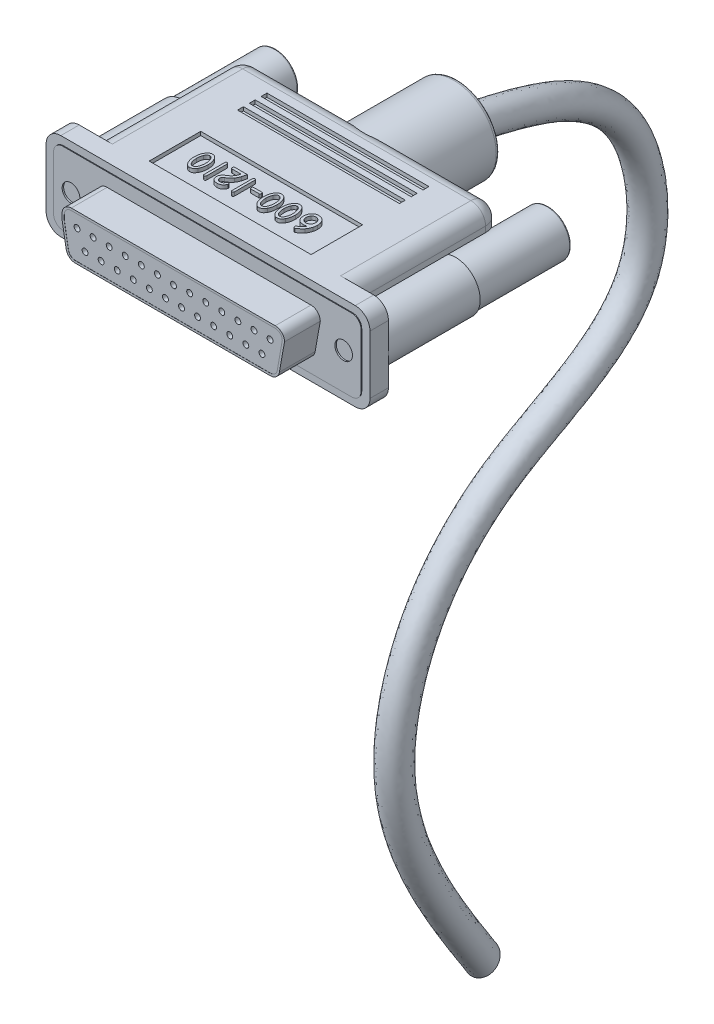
SolidWorks part; units mm, degrees
ref_plane "Plane1" through (0, 0, 0) normal (0, 0, 1) x (1, 0, 0)
ref_plane "Plane2" through (0, 0, 0) normal (0, 1, 0) x (1, 0, 0)
ref_plane "Plane3" through (0, 0, 0) normal (1, 0, 0) x (0, 0, -1)
extrude "Base-Extrude" add sketch "Sketch1" against normal blind 1.0668
sketch "Sketch1" plane through (0, 0, 0) normal (0, 0, 1) x (1, 0, 0)
  line L0 (0, 19.6596) -> (0, -19.1008) construction
  line L1 (-24.9174, 6.2738) -> (24.9174, 6.2738)
  line L2 (24.9174, -6.2738) -> (-24.9174, -6.2738)
  line L3 (26.5176, 4.6736) -> (26.5176, -4.6736)
  line L4 (-26.5176, 4.6736) -> (-26.5176, -4.6736)
  arc A0 (26.5176, 4.6736) -> (24.9174, 6.2738) centre (24.9174, 4.6736) ccw
  arc A1 (24.9174, -6.2738) -> (26.5176, -4.6736) centre (24.9174, -4.6736) ccw
  arc A2 (-26.5176, -4.6736) -> (-24.9174, -6.2738) centre (-24.9174, -4.6736) ccw
  arc A3 (-24.9174, 6.2738) -> (-26.5176, 4.6736) centre (-24.9174, 4.6736) ccw
  point P9 (26.5176, 6.2738)
  point P12 (26.5176, -6.2738)
  point P15 (-26.5176, -6.2738)
  point P18 (-26.5176, 6.2738)
  dimension "D1" = 1.6002
sketch "Sketch2" plane through (0, 0, -1.0668) normal (0, 0, -1) x (-1, 0, 0)
  line L0 (-26.5176, 6.2738) -> (26.5176, 6.2738)
  line L1 (-26.5176, 6.2738) -> (-26.5176, -6.2738)
  line L2 (26.5176, -6.2738) -> (-26.5176, -6.2738)
  line L3 (26.5176, -6.2738) -> (26.5176, 6.2738)
extrude "Boss-Extrude1" add sketch "Sketch2" along normal blind 6.477
sketch "Sketch10" plane through (0, 0, 0) normal (0, 0, 1) x (1, 0, 0)
  line L0 (0, 10.3378) -> (0, -10.8966) construction
  line L1 (-24.9174, 6.2738) -> (24.9174, 6.2738) construction
  circle A0 centre (23.5204, 0) radius 1.524
  circle A1 centre (-23.5204, 0) radius 1.524
  dimension "D1" = 3.048
  dimension "D2" = 6.2738
  dimension "D3" = 47.0408
extrude "Cut-Extrude5" cut sketch "Sketch10" against normal through all
ref_plane "Plane5" through (5.715, 0, 0) normal (1, 0, 0) x (0, 0, -1)
sketch "Sketch17" plane through (0, 6.2738, 0) normal (0, 1, 0) x (-1, 0, 0)
  line L8 (-24.9174, 0) -> (-24.9174, -1.0668)
  line L9 (-24.9174, -1.0668) -> (-26.5176, -1.0668)
  line L10 (-26.5176, -1.0668) -> (-26.5176, -7.5438)
  line L11 (-26.5176, -7.5438) -> (26.5176, -7.5438)
  line L12 (26.5176, -7.5438) -> (26.5176, -1.0668)
  line L13 (26.5176, -1.0668) -> (24.9174, -1.0668)
  line L14 (24.9174, -1.0668) -> (24.9174, 0)
  line L15 (24.9174, 0) -> (-24.9174, 0)
  line L17 (-24.9174, -1.0668) -> (-26.5176, -1.0668)
  line L18 (-26.5176, -1.0668) -> (-26.5176, -7.5438)
  line L19 (-26.5176, -7.5438) -> (26.5176, -7.5438)
  line L20 (26.5176, -7.5438) -> (26.5176, -1.0668)
  line L21 (26.5176, -1.0668) -> (-24.9174, -1.0668)
  dimension "D1" = 0
extrude "Cut-Extrude7" cut sketch "Sketch17" against normal through all
ref_plane "Plane6" through (0, 0, -0.127) normal (0, 0, 1) x (1, 0, 0)
sketch "Sketch18" plane through (0, 0, -0.127) normal (0, 0, 1) x (1, 0, 0)
  line L0 (-25.4, 7.5692) -> (25.4, 7.5692)
  line L1 (-27.94, 5.0292) -> (-27.94, -5.0292)
  line L2 (25.4, -7.5692) -> (-25.4, -7.5692)
  line L3 (27.94, -5.0292) -> (27.94, 5.0292)
  arc A0 (27.94, 5.0292) -> (25.4, 7.5692) centre (25.4, 5.0292) ccw
  arc A1 (25.4, -7.5692) -> (27.94, -5.0292) centre (25.4, -5.0292) ccw
  arc A2 (-27.94, -5.0292) -> (-25.4, -7.5692) centre (-25.4, -5.0292) ccw
  arc A3 (-25.4, 7.5692) -> (-27.94, 5.0292) centre (-25.4, 5.0292) ccw
  point P12 (23.5204, 0)
  point P13 (-23.5204, 0)
  dimension "D1" = 2.54
  dimension "D2" = 55.88
  dimension "D3" = 15.1384
  dimension "D4" = 7.5692
  dimension "D5" = 27.94
extrude "Boss-Extrude8" add sketch "Sketch18" against normal blind 3.175
sketch "Sketch19" plane through (0, 0, -3.302) normal (0, 0, -1) x (-1, 0, 0)
  line L0 (-19.685, 7.5692) -> (19.685, 7.5692)
  line L1 (-22.225, 5.0292) -> (-22.225, 4.0525)
  line L2 (19.685, -7.5692) -> (-19.685, -7.5692)
  line L3 (22.225, -5.0292) -> (22.225, -4.0525)
  line L4 (25.4, 7.5692) -> (-25.4, 7.5692) construction
  line L5 (-25.4, -7.5692) -> (25.4, -7.5692) construction
  line L6 (22.225, 4.0525) -> (22.225, 5.0292)
  line L7 (-22.225, -4.0525) -> (-22.225, -5.0292)
  arc A0 (22.225, 4.0525) -> (22.225, -4.0525) centre (23.5204, 0) ccw
  arc A1 (-22.225, -4.0525) -> (-22.225, 4.0525) centre (-23.5204, 0) ccw
  arc A2 (19.685, 7.5692) -> (22.225, 5.0292) centre (19.685, 5.0292) cw
  arc A3 (19.685, -7.5692) -> (22.225, -5.0292) centre (19.685, -5.0292) ccw
  arc A4 (-22.225, -5.0292) -> (-19.685, -7.5692) centre (-19.685, -5.0292) ccw
  arc A5 (-19.685, 7.5692) -> (-22.225, 5.0292) centre (-19.685, 5.0292) ccw
  point P20 (22.225, 7.5692)
  point P23 (22.225, -7.5692)
  point P28 (-22.225, 7.5692)
  dimension "D3" = 8.509
  dimension "D4" = 8.509
  dimension "D5" = 2.54
  dimension "D1" = 44.45
  dimension "D2" = 22.225
extrude "Boss-Extrude10" add sketch "Sketch19" along normal blind 25.019
fillet "Fillet10" radius 2.54 7 edges at (0, -7.5692, -28.321) (22.225, -4.5408, -28.321) (21.4811, -6.8253, -28.321) (-21.4811, -6.8253, -28.321) (-22.225, -4.5408, -28.321)
fillet "Fillet11" radius 2.54 7 edges at (-21.4811, 6.8253, -28.321) (0, 7.5692, -28.321) (-22.225, 4.5408, -28.321) (21.4811, 6.8253, -28.321) (22.225, 4.5408, -28.321)
sketch "Sketch20" plane through (0, 0, -0.127) normal (0, 0, 1) x (1, 0, 0)
  circle A1 centre (-23.5204, 0) radius 1.524
  circle A2 centre (-23.5204, 0) radius 1.524
  circle A3 centre (23.5204, 0) radius 1.524
  circle A4 centre (23.5204, 0) radius 1.524
  dimension "D1" = 0
  dimension "D2" = 0
sketch "Sketch21" plane through (0, 0, -3.302) normal (0, 0, -1) x (-1, 0, 0)
  circle A0 centre (23.5204, 0) radius 4.2545
  circle A1 centre (-23.5204, 0) radius 4.2545
  arc A2 (22.225, 4.0525) -> (22.225, -4.0525) centre (23.5204, 0) ccw construction
extrude "Boss-Extrude13" add sketch "Sketch21" along normal blind 16.002
sketch "Sketch23" plane through (0, 0, -19.304) normal (0, 0, -1) x (-1, 0, 0)
  circle A0 centre (23.5204, 0) radius 1.5875
  circle A1 centre (-23.5204, 0) radius 1.5875
  dimension "D1" = 3.175
  dimension "D2" = 3.175
extrude "Boss-Extrude14" add sketch "Sketch23" along normal blind 0.127
sketch "Sketch24" plane through (0, 0, -19.431) normal (0, 0, -1) x (-1, 0, 0)
  circle A0 centre (23.5204, 0) radius 3.937
  circle A1 centre (-23.5204, 0) radius 3.937
  dimension "D1" = 7.874
  dimension "D2" = 7.874
extrude "Boss-Extrude15" add sketch "Sketch24" along normal blind 15.875
extrude "Cut-Extrude9" cut sketch "Sketch20" against normal blind 0.127
fillet "Fillet12" radius 0.254 2 edges at (-27.4574, 0, -35.306) (19.5834, 0, -35.306)
sketch "Sketch25" plane through (0, 0, -35.306) normal (0, 0, -1) x (-1, 0, 0)
  line L0 (23.2987, 2.4625) -> (25.5122, -1.4647)
  line L1 (21.5286, 1.4647) -> (23.7421, -2.4625)
  line L2 (-23.7421, 2.4625) -> (-21.5286, -1.4647)
  line L3 (-25.5122, 1.4647) -> (-23.2987, -2.4625)
  arc A0 (24.5105, -2.7481) -> (25.3587, -2.27) centre (23.5204, 0) ccw
  arc A1 (23.2987, 2.4625) -> (22.5303, 2.7481) centre (22.7456, 2.1507) ccw
  arc A2 (21.5286, 1.4647) -> (21.6821, 2.27) centre (22.0817, 1.7765) cw
  arc A3 (24.5105, -2.7481) -> (23.7421, -2.4625) centre (24.2952, -2.1507) cw
  arc A4 (25.5122, -1.4647) -> (25.3587, -2.27) centre (24.9591, -1.7765) cw
  circle A5 centre (23.5204, 0) radius 2.921
  arc A6 (22.5303, 2.7481) -> (21.6821, 2.27) centre (23.5204, 0) ccw
  arc A9 (-22.5303, -2.7481) -> (-21.6821, -2.27) centre (-23.5204, 0) ccw
  arc A10 (-23.7421, 2.4625) -> (-24.5105, 2.7481) centre (-24.2952, 2.1507) ccw
  arc A11 (-25.5122, 1.4647) -> (-25.3587, 2.27) centre (-24.9591, 1.7765) cw
  arc A12 (-22.5303, -2.7481) -> (-23.2987, -2.4625) centre (-22.7456, -2.1507) cw
  arc A13 (-21.5286, -1.4647) -> (-21.6821, -2.27) centre (-22.0817, -1.7765) cw
  arc A14 (-24.5105, 2.7481) -> (-25.3587, 2.27) centre (-23.5204, 0) ccw
  dimension "D5" = 0.635
  dimension "D1" = 1.016
  dimension "D2" = 1.016
  dimension "D3" = 0.762
extrude "Cut-Extrude10" cut sketch "Sketch25" against normal blind 1.27
ref_plane "Plane7" through (0, 0, -43.18) normal (0, 0, 1) x (1, 0, 0)
sketch "Sketch26" plane through (0, 0, -43.18) normal (0, 0, 1) x (1, 0, 0)
  circle A0 centre (0, 0) radius 7.3025
  dimension "D1" = 14.605
extrude "Boss-Extrude16" add sketch "Sketch26" along normal up to next
fillet "Fillet13" radius 0.635 1 edges at (7.3025, 0, -43.18)
sketch "Sketch27" plane through (0, 0, -43.18) normal (0, 0, -1) x (-1, 0, 0)
  circle A0 centre (0, 0) radius 2.54
  dimension "D1" = 5.08
sketch "Sketch28" plane through (0, 0, 0) normal (1, 0, 0) x (0, 0, -1)
  point P1 (43.18, 0)
  point P3 (71.3232, -13.1826)
  point P4 (74.1426, -37.719)
  point P5 (47.3964, -58.166)
  point P6 (32.258, -90.043)
  point P7 (47.3964, -126.2634)
sweep "Boss-Sweep1" add profiles "Sketch27" path "Sketch28"
sketch "Sketch29" plane through (0.2961, -0.1665, 0) normal (0, 0, 1) x (1, 0, 0)
  line L0 (19.1897, 2.516) -> (18.3121, -2.4609)
  line L1 (-17.5895, 4.1162) -> (17.5895, 4.1162)
  line L2 (16.7363, -3.7832) -> (-16.8997, -3.7832)
  line L6 (-19.1897, 1.5889) -> (-18.4756, -2.4609)
  line L7 (-19.1897, 2.516) -> (-19.1897, 1.5889)
  arc A0 (17.5895, 4.1162) -> (19.1897, 2.516) centre (17.5895, 2.516) cw
  arc A1 (18.3121, -2.4609) -> (16.7363, -3.7832) centre (16.7363, -2.183) cw
  arc A2 (-18.4756, -2.4609) -> (-16.8997, -3.7832) centre (-16.8997, -2.183) ccw
  arc A3 (-17.5895, 4.1162) -> (-19.1897, 2.516) centre (-17.5895, 2.516) ccw
  point P6 (-23.8165, 0.1665)
  point P7 (23.2243, 0.1665)
  point P26 (-19.1897, 4.1162)
  dimension "D7" = 1.6002
  dimension "D1" = 1.6002
  dimension "D2" = 7.8994
  dimension "D3" = 3.9497
  dimension "D6" = 10
extrude "Boss-Extrude17" add sketch "Sketch29" along normal blind 6.1722
sketch "Sketch30" plane through (0, 0, 6.1722) normal (0, 0, 1) x (1, 0, 0)
  line L15 (18.233, -2.5612) -> (19.1044, 2.3806)
  line L16 (17.8856, 3.5687) -> (-17.2934, 3.5687)
  line L17 (-18.5126, 2.3495) -> (-18.5126, 1.4557)
  line L18 (-18.5126, 1.4557) -> (-17.8043, -2.5612)
  line L19 (-16.6036, -3.5687) -> (17.0323, -3.5687)
  line L20 (18.233, -2.5612) -> (19.1044, 2.3806)
  line L21 (17.8856, 3.5687) -> (-17.2934, 3.5687)
  line L22 (-18.5126, 2.3495) -> (-18.5126, 1.4557)
  line L23 (-18.5126, 1.4557) -> (-17.8043, -2.5612)
  line L24 (-16.6036, -3.5687) -> (17.0323, -3.5687)
  arc A12 (17.0323, -3.5687) -> (18.233, -2.5612) centre (17.0323, -2.3495) ccw
  arc A13 (19.1044, 2.3806) -> (17.8856, 3.5687) centre (17.8856, 2.3495) ccw
  arc A14 (-17.2934, 3.5687) -> (-18.5126, 2.3495) centre (-17.2934, 2.3495) ccw
  arc A15 (-17.8043, -2.5612) -> (-16.6036, -3.5687) centre (-16.6036, -2.3495) ccw
  arc A16 (17.0323, -3.5687) -> (18.233, -2.5612) centre (17.0323, -2.3495) ccw
  arc A17 (19.1044, 2.3806) -> (17.8856, 3.5687) centre (17.8856, 2.3495) ccw
  arc A18 (-17.2934, 3.5687) -> (-18.5126, 2.3495) centre (-17.2934, 2.3495) ccw
  arc A19 (-17.8043, -2.5612) -> (-16.6036, -3.5687) centre (-16.6036, -2.3495) ccw
  dimension "D2" = 0.381
extrude "Cut-Extrude11" cut sketch "Sketch30" against normal blind 0.0254
sketch "Sketch32" plane through (0.3166, -0.1876, 6.1468) normal (0, 0, 1) x (1, 0, 0)
  circle A0 centre (0, 1.4224) radius 0.508
  circle A2 centre (16.6497, 1.61) radius 0.508
  circle A3 centre (11.1023, 1.61) radius 0.508
  circle A4 centre (-2.7813, 1.61) radius 0.508
  circle A5 centre (8.3287, 1.61) radius 0.508
  circle A6 centre (-8.3287, 1.61) radius 0.508
  circle A7 centre (5.555, 1.61) radius 0.508
  circle A8 centre (-11.1023, 1.61) radius 0.508
  circle A9 centre (2.7813, 1.61) radius 0.508
  circle A10 centre (-13.876, 1.61) radius 0.508
  circle A11 centre (13.876, 1.61) radius 0.508
  circle A12 centre (-16.6497, 1.61) radius 0.508
  circle A13 centre (15.2476, -1.2348) radius 0.508
  circle A25 centre (-5.555, 1.61) radius 0.508
  circle A26 centre (-15.2629, -1.2348) radius 0.508
  circle A27 centre (12.4739, -1.2348) radius 0.508
  circle A28 centre (-12.4892, -1.2348) radius 0.508
  circle A29 centre (9.7003, -1.2348) radius 0.508
  circle A30 centre (-9.7155, -1.2348) radius 0.508
  circle A31 centre (6.9266, -1.2348) radius 0.508
  circle A32 centre (-6.9418, -1.2348) radius 0.508
  circle A33 centre (4.1529, -1.2348) radius 0.508
  circle A34 centre (-4.1681, -1.2348) radius 0.508
  circle A35 centre (1.3792, -1.2348) radius 0.508
  circle A36 centre (-1.3945, -1.2348) radius 0.508
  dimension "D2" = 1.016
  dimension "D5" = 2.7737
  dimension "D6" = 2.7737
  dimension "D7" = 2.7737
  dimension "D8" = 2.7737
  dimension "D9" = 2.7737
  dimension "D10" = 2.7737
  dimension "D11" = 2.7737
  dimension "D12" = 2.7737
  dimension "D13" = 2.7737
  dimension "D14" = 2.7737
  dimension "D15" = 1.3868
  dimension "D16" = 2.7737
  dimension "D17" = 2.7737
  dimension "D18" = 2.7737
  dimension "D19" = 2.7737
  dimension "D20" = 2.7737
  dimension "D21" = 2.7737
  dimension "D22" = 2.7737
  dimension "D23" = 2.7737
  dimension "D24" = 2.7737
  dimension "D25" = 2.7737
  dimension "D26" = 2.7737
extrude "Cut-Extrude12" cut sketch "Sketch32" against normal up to surface (6.1468 mm away)
sketch "Sketch33" plane through (0, 7.5692, 0) normal (0, 1, 0) x (-1, 0, 0)
  line L0 (-13.97, -19.177) -> (-13.97, -20.193)
  line L1 (13.97, -23.241) -> (13.97, -24.257)
  line L2 (-13.97, -12.827) -> (-13.97, -3.937)
  line L3 (13.97, -3.937) -> (13.97, -12.827)
  line L4 (-13.97, -3.937) -> (13.97, -3.937)
  line L5 (-13.97, -12.827) -> (13.97, -12.827)
  line L6 (25.4, -0.127) -> (-25.4, -0.127) construction
  line L7 (13.97, -19.177) -> (13.97, -20.193)
  line L8 (13.97, -24.257) -> (-13.97, -24.257)
  line L9 (13.97, -23.241) -> (-13.97, -23.241)
  line L10 (13.97, -22.225) -> (-13.97, -22.225)
  line L11 (13.97, -21.209) -> (-13.97, -21.209)
  line L12 (13.97, -20.193) -> (-13.97, -20.193)
  line L13 (13.97, -19.177) -> (-13.97, -19.177)
  line L14 (-13.97, -23.241) -> (-13.97, -24.257)
  line L15 (-13.97, -21.209) -> (-13.97, -22.225)
  line L16 (13.97, -21.209) -> (13.97, -22.225)
  dimension "D1" = 6.35
  dimension "D2" = 1.016
  dimension "D3" = 3.81
  dimension "D4" = 8.89
  dimension "D5" = 1.016
  dimension "D6" = 1.016
  dimension "D7" = 1.016
  dimension "D8" = 1.016
extrude "Cut-Extrude13" cut sketch "Sketch33" against normal blind 0.635
sketch "Sketch34" plane through (0, 7.5692, 0) normal (0, 1, 0) x (-1, 0, 0)
  text T0 "600-1210"
  point P1 (0, 0)
extrude "Boss-Extrude18" add sketch "Sketch34" along normal up to surface (0.635 mm away)
